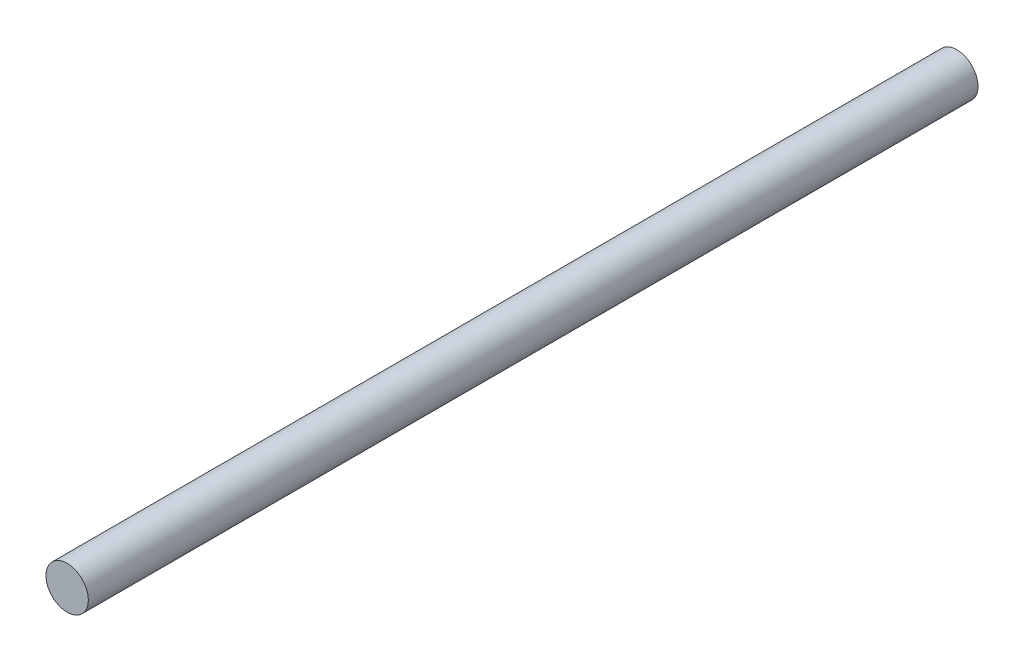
SolidWorks part; units mm, degrees
ref_plane "Front" through (0, 0, 0) normal (0, 0, 1) x (1, 0, 0)
ref_plane "Top" through (0, 0, 0) normal (0, 1, 0) x (1, 0, 0)
ref_plane "Right" through (0, 0, 0) normal (1, 0, 0) x (0, 0, -1)
sketch "Esquisse1" plane through (0, 0, 0) normal (0, 0, 1) x (1, 0, 0)
  circle A0 centre (0, 0) radius 1.5
  dimension "D1" = 3
extrude "Boss.-Extru.1" add sketch "Esquisse1" along normal blind 63
